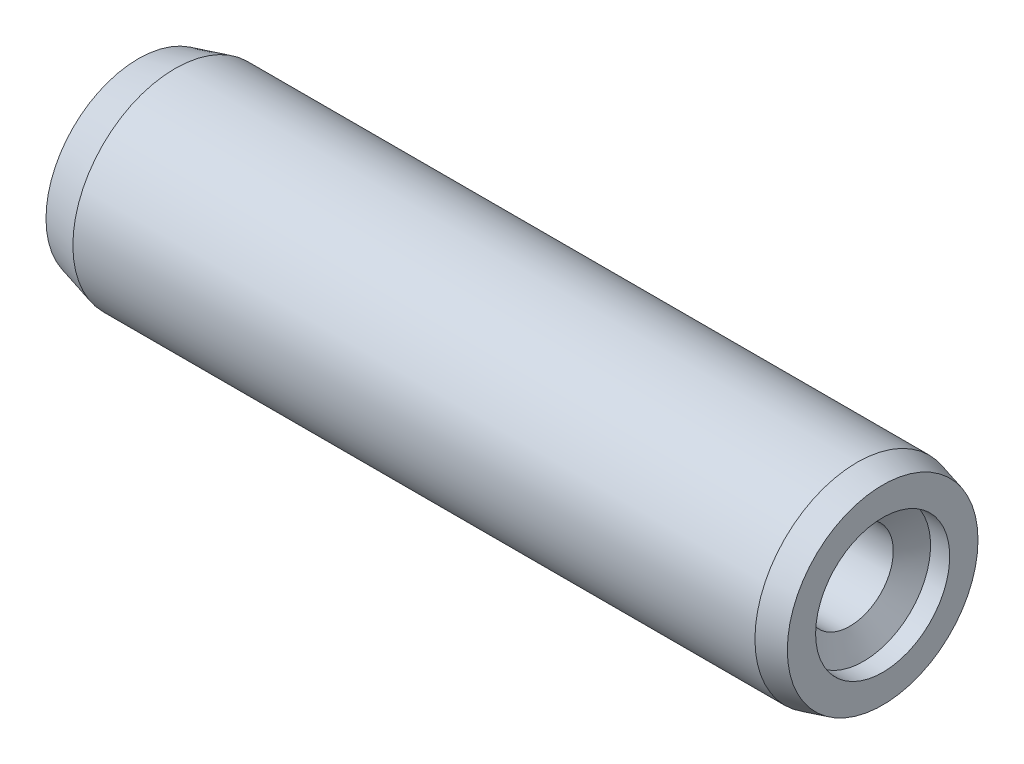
SolidWorks part; units mm, degrees
ref_plane "Plane1" through (0, 0, 0) normal (0, 0, 1) x (1, 0, 0)
ref_plane "Plane2" through (0, 0, 0) normal (0, 1, 0) x (1, 0, 0)
ref_plane "Plane3" through (0, 0, 0) normal (1, 0, 0) x (0, 0, -1)
sketch "BodySke" plane through (0, 0, 0) normal (0, 0, 1) x (1, 0, 0)
  line L0 (0, 0) -> (66, 0) construction
  line L1 (0, 0) -> (40, 0) construction
  line L2 (4.6, 8) -> (58, 8)
  line L3 (58, 8) -> (60, 7.4641)
  line L4 (0, 0) -> (33.5917, 0)
  line L5 (60, 7.4641) -> (60, 5.25)
  line L6 (60, 5.25) -> (58.5, 5.25)
  line L7 (58.5, 5.25) -> (57.4319, 3.4)
  line L8 (57.4319, 3.4) -> (35, 3.4)
  line L9 (35, 3.4) -> (33.5917, 0)
  line L10 (57.25, 7) -> (57.25, 3) construction
  line L11 (44, 16) -> (44, 0) construction
  line L12 (4.6, 8) -> (1.7268, 7.2301)
  arc A0 (1.7268, 7.2301) -> (0, 0) centre (16, 0) ccw
  dimension "D3" = 67.5
  dimension "D2" = 165
  dimension "Crown_rad" = 16
  dimension "D1" = 75
  dimension "Diameter" = 16
  dimension "Length" = 60
  dimension "Head_ch_len" = 2
  dimension "Cbore_dia" = 10.5
  dimension "Cbore_dep" = 1.5
  dimension "Tapdrill_dia" = 6.8
  dimension "Tapdrill_dep" = 25
  dimension "D4" = 30
  dimension "Advance" = 1.25
  dimension "Thread_dep" = 16
  dimension "Tip_ch_len" = 4.6
revolve "Body" add sketch "BodySke" angle 360 about L0
sketch "ThdSchSke" plane through (0, 0, 0) normal (0, 0, 1) x (1, 0, 0)
  line L0 (57.7783, 4) -> (58.2618, 3.3095)
  line L2 (57.7783, 4) -> (57.2948, 3.3095)
  line L3 (57.2948, 3.3095) -> (58.2618, 3.3095)
  line L4 (57.7783, 5.8566) -> (57.7783, 1.7596) construction
  line L5 (27, 0) -> (36, 0) construction
  line L6 (0, 0) -> (66, 0) construction
  line L7 (60, -7.4641) -> (60, 7.4641) construction
  dimension "D1" = 70
  dimension "Thread_nominal" = 8
  dimension "Inset" = 2.2217
  dimension "Thread_minor" = 6.619
revolve "ThreadSchematic" [suppressed] cut sketch "ThdSchSke" angle 360 about L5
pattern_linear "ThdSchPat" [suppressed]
equation "' \"Diameter@BodySke\" = 16"
equation "' \"Head_ch_len@BodySke\" = 2"
equation "' \"Tip_ch_len@BodySke\" = 4.6"
equation "' \"Thread_major@ThreadCosmetic\"  = 8"
equation "' \"Advance@BodySke\" = 1.25"
equation "' \"Cbore_dia@BodySke\" = 10.5"
equation "' \"Thread_dep@BodySke\"  = 16"
equation "' \"Tapdrill_dep@BodySke\" = 25"
equation "' \"Cbore_dep@BodySke\" = 1.5"
equation "' \"Tapdrill_dia@BodySke\" = 6.8"
equation "' \"Thread_minor@ThdSchSke\" = 6.619"
equation "'  \"Length@BodySke\" = 60"
equation "' \"Diameter@BodySke\" = 30"
equation "' \"Head_ch_len@BodySke\" = 4"
equation "' \"Tip_ch_len@BodySke\" = 7"
equation "' \"Thread_major@ThreadCosmetic\"  = 20"
equation "' \"Advance@BodySke\" = 2.5"
equation "' \"Cbore_dia@BodySke\" = 21"
equation "' \"Thread_dep@BodySke\"  = 30"
equation "' \"Tapdrill_dep@BodySke\" = 40"
equation "' \"Cbore_dep@BodySke\" = 2"
equation "' \"Tapdrill_dia@BodySke\" = 17.5"
equation "' \"Thread_minor@ThdSchSke\" = 17.252"
equation "\"Crown_rad@BodySke\" = \"Diameter@BodySke\" "
equation "\"Depth@ThreadCosmetic\" = \"Thread_dep@BodySke\"  -  \"Cbore_dep@BodySke\""
equation "\"Thread_nominal@ThdSchSke\" = \"Thread_major@ThreadCosmetic\""
equation "\"Inset@ThdSchSke\" = \"Cbore_dep@BodySke\" + (\"Cbore_dia@BodySke\" - \"Thread_major@ThreadCosmetic\") / 2 * tan(30 * 0.0174533)"
equation "\"Num_threads@ThdSchPat\" = int(  ( \"Thread_dep@BodySke\"  - \"Inset@ThdSchSke\" ) / \"Advance@BodySke\" + 0.999 )  + 1"
equation "\"Advance@ThdSchPat\" = (  \"Thread_dep@BodySke\" - \"Inset@ThdSchSke\" ) /  (\"Num_threads@ThdSchPat\" - 1) 'relax it"
